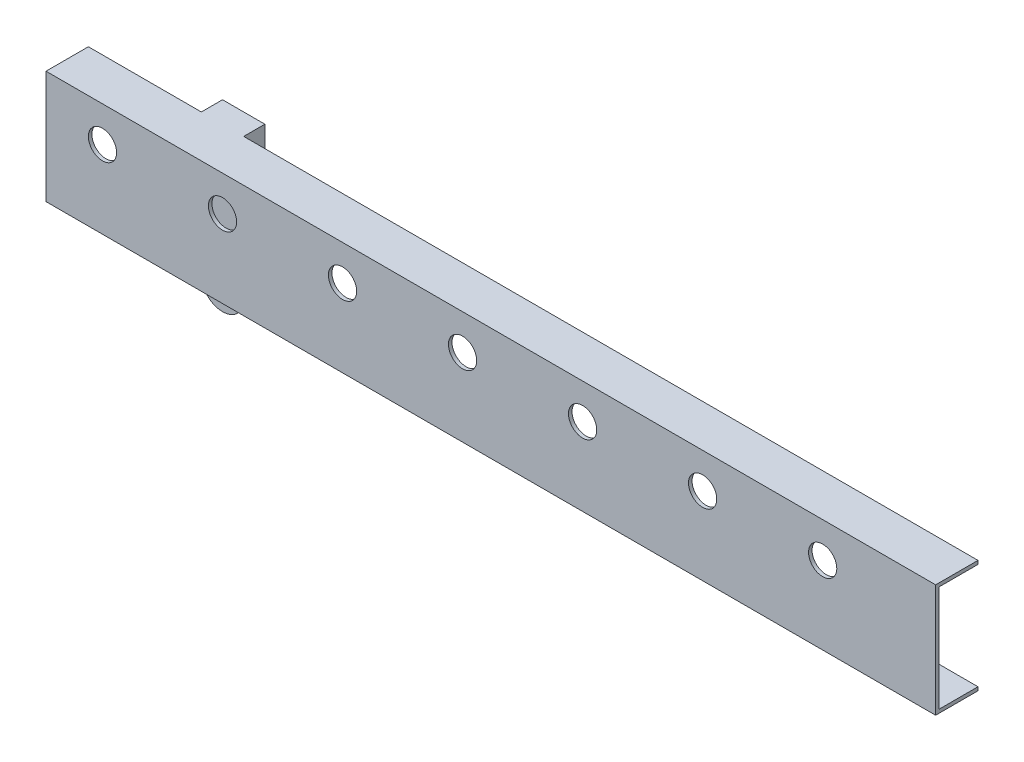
SolidWorks part; units mm, degrees
ref_plane "Plane1" through (0, 0, 0) normal (0, 0, 1) x (1, 0, 0)
ref_plane "Plane2" through (0, 0, 0) normal (0, 1, 0) x (1, 0, 0)
ref_plane "Plane3" through (0, 0, 0) normal (1, 0, 0) x (0, 0, -1)
mirrored part "pivot_rh_rail1_Mirrored"
other "<pivot_rh_rail1>-<Boss-Extrude1>"
